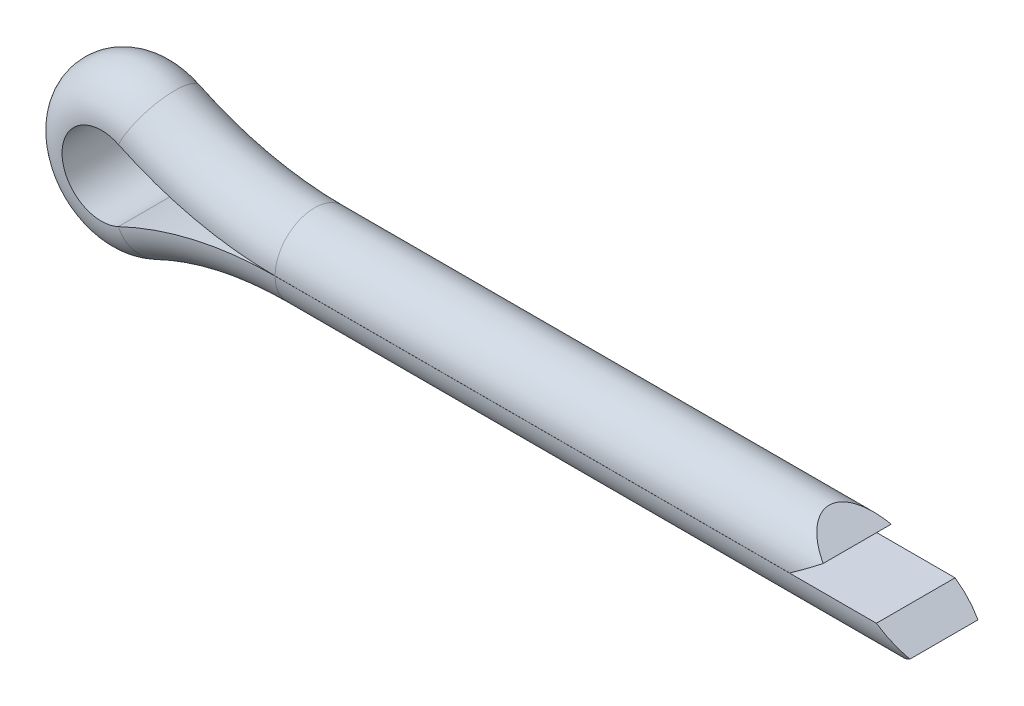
SolidWorks part; units mm, degrees
ref_plane "Front Plane" through (0, 0, 0) normal (0, 0, 1) x (1, 0, 0)
ref_plane "Top Plane" through (0, 0, 0) normal (0, 1, 0) x (1, 0, 0)
ref_plane "Right Plane" through (0, 0, 0) normal (1, 0, 0) x (0, 0, -1)
other "Configuration Table"
sketch "PathSke" plane through (0, 0, 0) normal (0, 0, 1) x (1, 0, 0)
  line L0 (0, 0) -> (38.8652, 0) construction
  line L1 (0, 0) -> (0, 12.2501) construction
  line L2 (6.4, 0) -> (6.4, 12.2501) construction
  line L3 (6.4, 1.45) -> (26.4, 1.45)
  line L4 (6.4, -1.45) -> (29.6, -1.45)
  arc A0 (1.2499, 2.6168) -> (1.2499, -2.6168) centre (0, 0) ccw
  arc A1 (6.4, 1.45) -> (1.2499, 2.6168) centre (6.4, 13.3991) cw
  arc A2 (6.4, -1.45) -> (1.2499, -2.6168) centre (6.4, -13.3991) ccw
ref_plane "SectionPlane" through (26.4, 1.45, 0) normal (1, 0, 0) x (0, 0, -1)
sketch "SectionSke" plane through (26.4, 1.45, 0) normal (1, 0, 0) x (0, 0, -1)
  line L0 (0, -1.45) -> (0, 8.6928) construction
  line L1 (0, -1.45) -> (0, 10.8001) construction
  line L2 (-1.45, -1.45) -> (1.45, -1.45) construction
  line L3 (-1.45, -1.448) -> (1.45, -1.448)
  arc A0 (1.45, -1.448) -> (-1.45, -1.448) centre (0, -1.45) ccw
sweep "BaseBody" add profiles "SectionSke" path "PathSke"
sketch "ConeCutSke" plane through (0, 0, 0) normal (0, 0, 1) x (1, 0, 0)
  line L0 (0, 0) -> (34.6884, 0) construction
  line L1 (25.3575, 1.46) -> (29.61, 1.46)
  line L2 (29.61, 1.46) -> (29.61, -1.46)
  line L3 (26.4, 1.45) -> (6.4, 1.45) construction
  line L4 (25.3575, 1.46) -> (26.4, 0.726)
  line L5 (26.4, 0.002) -> (26.4, 1.45) construction
  line L6 (26.4, 0.726) -> (25.3575, 0)
  line L7 (25.3575, 0) -> (28.5575, 0)
  line L8 (28.5575, 0) -> (29.6, -0.726)
  line L9 (29.6, -1.45) -> (29.6, -0.002) construction
  line L10 (29.6, -0.726) -> (28.5575, -1.46)
  line L11 (28.5575, -1.46) -> (29.61, -1.46)
  point P19 (29.61, 0)
  dimension "D1" = 0.01
  dimension "D2" = 70
  dimension "D3" = 70
  dimension "D4" = 0.01
extrude "ConeCut" cut sketch "ConeCutSke" against normal through all and the other way through all
equation "\"Diameter@SectionSke\" = \"Diameter@PathSke\""
